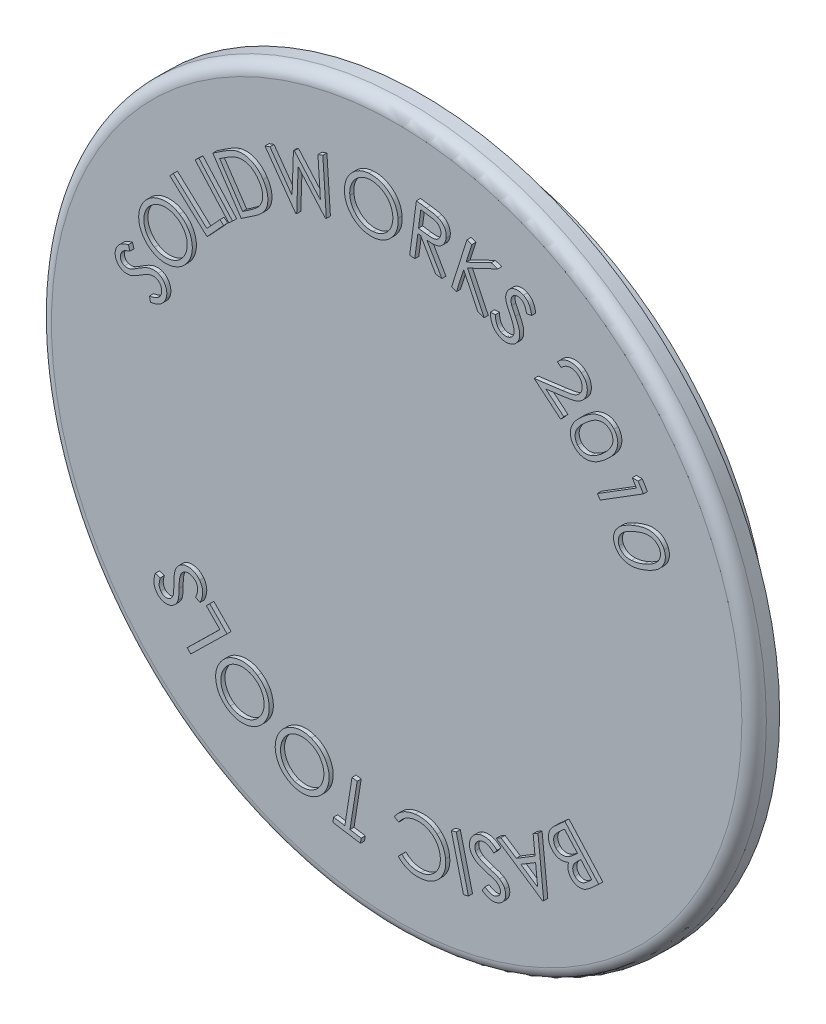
SolidWorks part; units mm, degrees
ref_plane "Front" through (0, 0, 0) normal (0, 0, 1) x (1, 0, 0)
ref_plane "Top" through (0, 0, 0) normal (0, 1, 0) x (1, 0, 0)
ref_plane "Right" through (0, 0, 0) normal (1, 0, 0) x (0, 0, -1)
sketch "Sketch1" plane through (0, 0, 0) normal (0, 0, 1) x (1, 0, 0)
  circle A0 centre (0, -38.1) radius 19.05 construction
  circle A1 centre (0, -38.1) radius 19.05
extrude "Extrude1" add sketch "Sketch1" against normal up to surface (2.54 mm away)
sketch "Sketch2" plane through (0, 0, 0) normal (0, 0, 1) x (1, 0, 0)
  circle A0 centre (0, -38.1) radius 22.225
  arc A1 (0, -15.875) -> (-1.0887, -60.2983) centre (0, -38.1) ccw construction
extrude "Extrude2" add sketch "Sketch2" along normal blind 1.5875
fillet "Fillet1" radius 0.762 1 edges at (22.225, -38.1, 1.5875)
sketch "Sketch3" plane through (0, 0, 1.5875) normal (0, 0, 1) x (1, 0, 0)
  arc A0 (15.113, -38.1) -> (-15.113, -38.1) centre (0, -38.1) ccw construction
  circle A2 centre (0, -38.1) radius 15.113
  arc A3 (-15.113, -38.1) -> (15.113, -38.1) centre (0, -38.1) ccw construction
  text T0 "SOLIDWORKS 2010    " font "Century Gothic" height in points 12
  text T1 "BASIC TOOLS       " font "Century Gothic" height in points 12
  dimension "D1" = 6.35
extrude "Extrude3" add sketch "Sketch3" along normal blind 0.254
